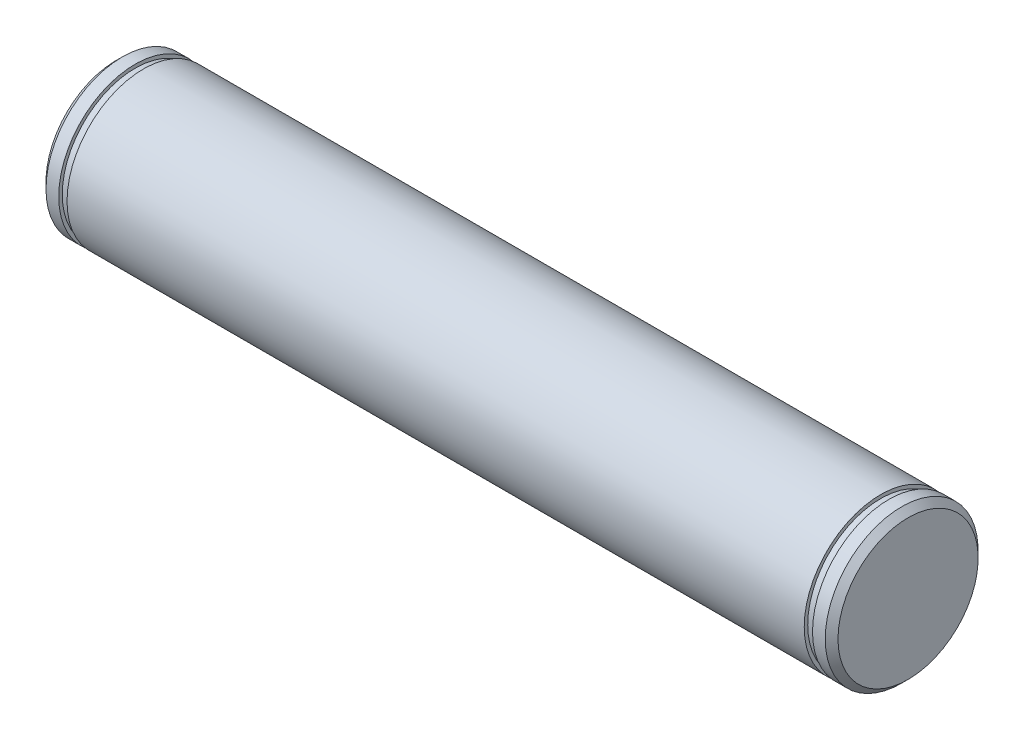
SolidWorks part; units mm, degrees
ref_plane "Plan1" through (0, 0, 0) normal (0, 0, 1) x (1, 0, 0)
ref_plane "Plan2" through (0, 0, 0) normal (0, 1, 0) x (1, 0, 0)
ref_plane "Plan3" through (0, 0, 0) normal (1, 0, 0) x (0, 0, -1)
sketch "Esquisse1" plane through (0, 0, 0) normal (0, 0, 1) x (1, 0, 0)
  line L0 (-130, 0) -> (140, 0) construction
  line L1 (-100, 0) -> (-100, 12)
  line L2 (-100, 12) -> (-97, 12)
  line L3 (24.32, 12) -> (24.32, 0)
  line L4 (-97, 12) -> (-97, 11.45)
  line L6 (21.32, 12) -> (21.32, 11.45)
  line L7 (-95.7, 12) -> (-95.7, 11.45)
  line L8 (20.02, 12) -> (20.02, 11.45)
  line L9 (20.02, 11.45) -> (21.32, 11.45)
  line L10 (-95.7, 12) -> (20.02, 12)
  line L11 (-97, 11.45) -> (-95.7, 11.45)
  line L12 (21.32, 12) -> (24.32, 12)
  line L13 (24.32, 0) -> (-100, 0)
  dimension "D1" = 118.32
  dimension "D2" = 3
  dimension "D3" = 3
  dimension "D4" = 1.3
  dimension "D5" = 1.3
  dimension "D6" = 22.9
revolve "Base-Révolution" add sketch "Esquisse1" angle 360 about L0
chamfer "Chanfrein1" distance 1 angle 45 2 edges at (24.32, 0, 12) (-100, 0, 12)
ref_plane "Plan4" through (0, -12, 0) normal (0, 1, 0) x (-1, 0, 0)
sketch "Esquisse3" plane through (0, 0, 0) normal (0, 0, 1) x (1, 0, 0)
  line L0 (-43.84, -12) -> (-37.84, -12)
  line L2 (-37.84, 12) -> (-37.84, -11.7544) construction
  line L3 (20.02, 12) -> (-95.7, 12) construction
  line L4 (-37.84, -6) -> (-43.84, -12)
  line L5 (-37.84, -6) -> (-37.84, -12)
  line L6 (50, -12) -> (-50, -12) construction
  dimension "D1" = 45
  dimension "D2" = 6
revolve "Enlèvement de matière-Révolution2" cut sketch "Esquisse3" angle 360 about L2
